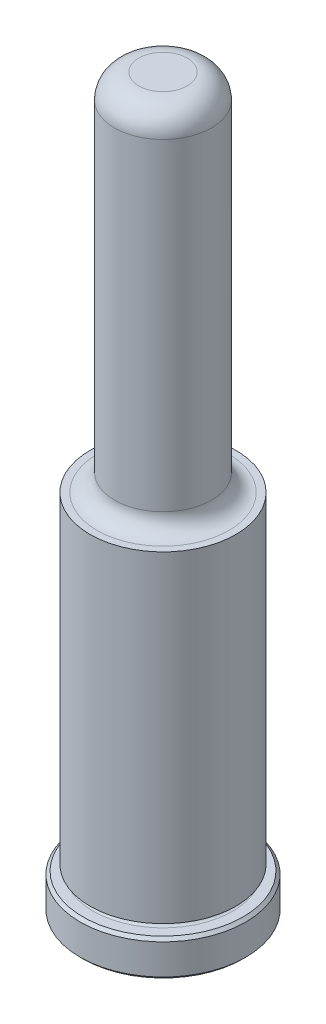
SolidWorks part; units mm, degrees
ref_plane "Front Plane" through (0, 0, 0) normal (0, 0, 1) x (1, 0, 0)
ref_plane "Top Plane" through (0, 0, 0) normal (0, 1, 0) x (1, 0, 0)
ref_plane "Right Plane" through (0, 0, 0) normal (1, 0, 0) x (0, 0, -1)
sketch "Sketch1" plane through (0, 0, 0) normal (1, 0, 0) x (0, 0, -1)
  line L0 (0, 0) -> (10.8331, 0)
  line L1 (10.8331, 0) -> (10.8331, 4.7498)
  line L2 (10.8331, 4.7498) -> (9.1313, 4.7498)
  line L3 (8.7503, 2.6782) -> (8.7503, 5.9795) construction
  line L4 (9.1313, 5.5118) -> (9.5377, 5.5118)
  line L5 (9.5377, 5.5118) -> (9.5377, 47.625)
  line L6 (9.5377, 47.625) -> (8.6233, 47.625)
  line L7 (6.3373, 49.911) -> (6.3373, 95.25)
  line L9 (6.3373, 95.25) -> (0, 95.25)
  line L10 (0, 95.25) -> (0, 0)
  line L11 (0, 0) -> (0, -7.2694) construction
  arc A0 (9.1313, 5.5118) -> (9.1313, 4.7498) centre (9.1313, 5.1308) ccw
  arc A1 (8.6233, 47.625) -> (6.3373, 49.911) centre (8.6233, 49.911) cw
  point P2 (6.3373, 95.25)
  point P14 (6.3373, 95.1374)
  point P19 (6.3373, 47.625)
  dimension "D14" = 0.762
  dimension "D8" = 2.286
  dimension "T" = 4.7498
  dimension "D2" = 0.762
  dimension "M" = 21.6662
  dimension "B" = 19.0754
  dimension "L" = 95.25
  dimension "D7" = 0.7874
  dimension "A" = 47.625
  dimension "D" = 12.6746
  dimension "D15" = 47.625
revolve "Revolve1" add sketch "Sketch1" angle 360 about L11
fillet "Fillet6" radius 1.5875
chamfer "Chamfer1" distance 0.381 angle 45 2 edges at (0, 0, 10.8331) (0, 4.7498, 10.8331)
fillet "Fillet7" radius 3.175 1 edges at (0, 95.25, 6.3373)
